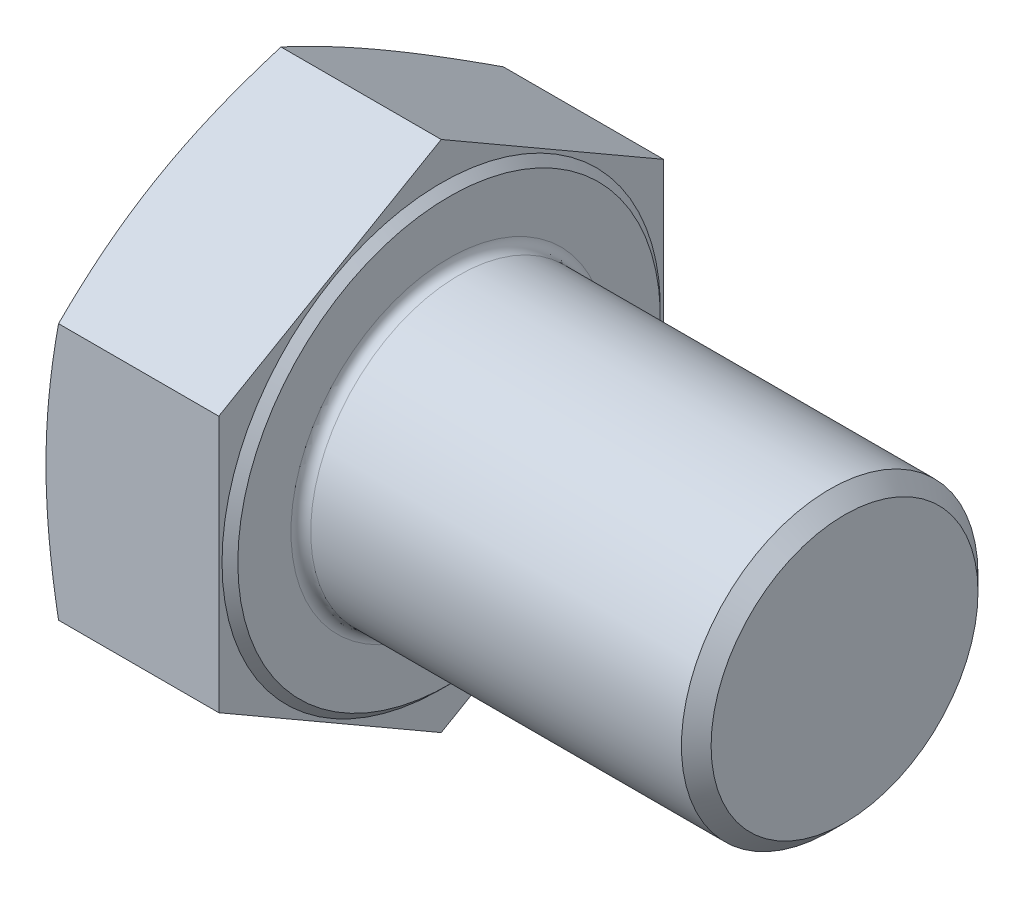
SolidWorks part; units mm, degrees
ref_plane "Front" through (0, 0, 0) normal (0, 0, 1) x (1, 0, 0)
ref_plane "Top" through (0, 0, 0) normal (0, 1, 0) x (1, 0, 0)
ref_plane "Right" through (0, 0, 0) normal (1, 0, 0) x (0, 0, -1)
sketch "Sketch2" plane through (0, 0, 0) normal (1, 0, 0) x (0, 0, -1)
  line L1 (22.5, -12.9904) -> (22.5, 12.9904)
  line L2 (22.5, 12.9904) -> (0, 25.9808)
  line L3 (0, 25.9808) -> (-22.5, 12.9904)
  line L4 (-22.5, 12.9904) -> (-22.5, -12.9904)
  line L5 (-22.5, -12.9904) -> (0, -25.9808)
  line L6 (0, -25.9808) -> (22.5, -12.9904)
  circle A0 centre (0, 0) radius 22.5 construction
  dimension "s" = 45
extrude "BaseHead" add sketch "Sketch2" along normal blind 18.28
sketch "Sketch3" plane through (0, 0, 0) normal (0, 0, 1) x (1, 0, 0)
  line L0 (18.28, 25.9808) -> (18.28, 21.375)
  line L2 (18.28, 21.375) -> (17.48, 22.175)
  line L3 (17.48, 22.175) -> (17.48, 25.9808)
  line L5 (17.48, 25.9808) -> (18.28, 25.9808)
  line L6 (-0.9571, 0) -> (7.6478, 0) construction
  line L7 (18.28, 25.9808) -> (0, 25.9808) construction
  dimension "D1" = 45
  dimension "c" = 0.8
  dimension "dw" = 42.75
revolve "BearingFace" cut sketch "Sketch3" angle 360 about L6
sketch "Sketch4" plane through (0, 0, 0) normal (0, 0, 1) x (1, 0, 0)
  line L0 (-0.4935, 0) -> (3.5626, 0) construction
  line L2 (0, 25.9808) -> (1.2669, 25.9808)
  line L4 (1.2669, 25.9808) -> (0, 22.5)
  line L6 (0, 22.5) -> (0, 25.9808)
  line L7 (17.48, 25.9808) -> (0, 25.9808) construction
  dimension "D1" = 20
  dimension "D2" = 45
revolve "HeadChamfer" cut sketch "Sketch4" angle 360 about L0
sketch "Sketch5" plane through (18.28, 0, 0) normal (1, 0, 0) x (0, 0, -1)
  circle A0 centre (0, 0) radius 15
  dimension "d" = 30
extrude "BaseBody" add sketch "Sketch5" along normal blind 40
chamfer "Chamfer1" distance 1.5 angle 45 1 edges at (58.28, 0, -15)
fillet "HeadFillet" radius 1 1 edges at (18.28, 0, -15)
equation "\"D2@Sketch4\" = \"s@Sketch2\""
equation "\"D1@Chamfer1\" = 0.05 * \"d@Sketch5\""
